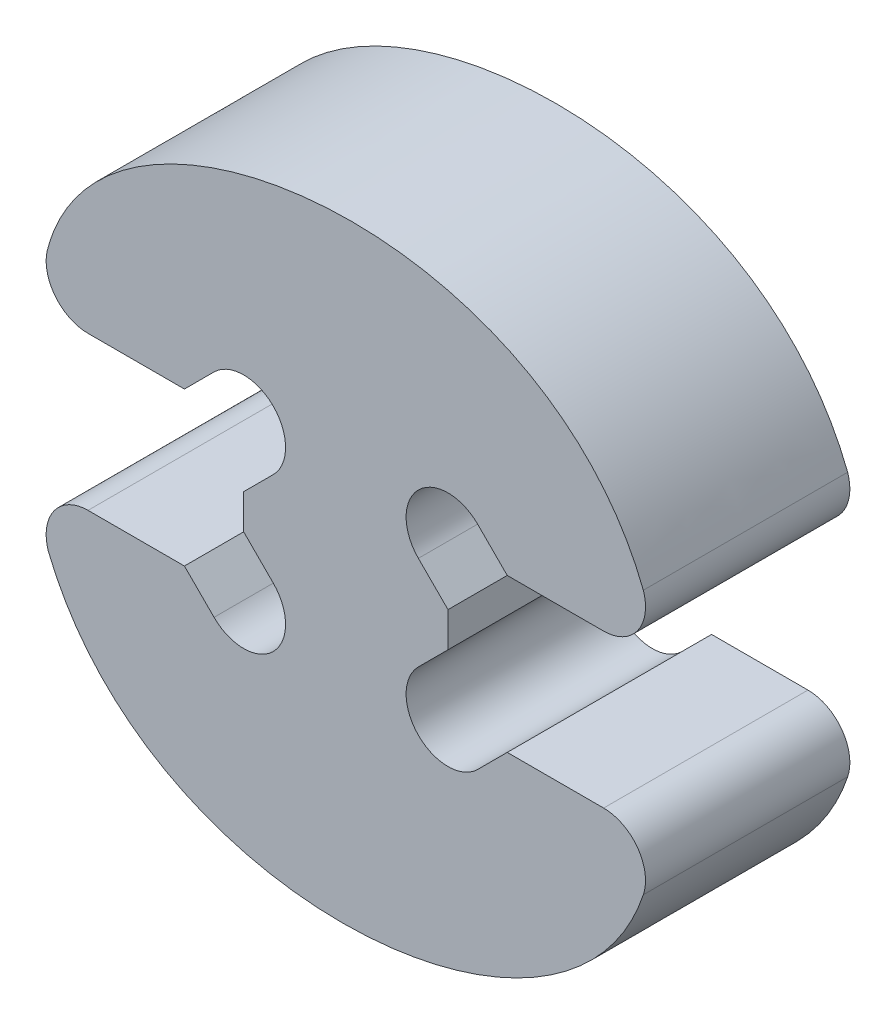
SolidWorks part; units mm, degrees
ref_plane "Front Plane" through (0, 0, 0) normal (0, 0, 1) x (1, 0, 0)
ref_plane "Top Plane" through (0, 0, 0) normal (0, 1, 0) x (1, 0, 0)
ref_plane "Right Plane" through (0, 0, 0) normal (1, 0, 0) x (0, 0, -1)
sketch "Model" plane through (0, 0, 0) normal (0, 0, 1) x (1, 0, 0)
  line L4 (543.2322, 187.641) -> (533.7957, 187.641)
  line L5 (533.7957, 187.641) -> (530.8965, 184.7419)
  line L6 (525.0983, 190.5401) -> (527.9974, 193.4393)
  line L7 (527.9974, 193.4393) -> (527.9974, 196.8427)
  line L8 (527.9974, 196.8427) -> (525.0983, 199.7419)
  line L9 (530.8965, 205.5401) -> (533.7957, 202.641)
  line L10 (533.7957, 202.641) -> (543.2322, 202.641)
  line L11 (492.7627, 202.641) -> (502.1991, 202.641)
  line L12 (502.1991, 202.641) -> (505.0983, 205.5401)
  line L13 (510.8965, 199.7419) -> (507.9974, 196.8427)
  line L14 (507.9974, 196.8427) -> (507.9974, 193.4393)
  line L15 (507.9974, 193.4393) -> (510.8965, 190.5401)
  line L16 (505.0983, 184.7419) -> (502.1991, 187.641)
  line L17 (502.1991, 187.641) -> (492.7627, 187.641)
  arc A0 (488.877, 182.2329) -> (490.7593, 178.2111) centre (507.014, 188.2701) ccw
  arc A1 (490.7593, 178.2111) -> (493.6192, 174.5278) centre (509.5533, 189.8515) ccw
  arc A2 (493.6192, 174.5278) -> (497.3539, 171.315) centre (512.3895, 192.5705) ccw
  arc A3 (497.3539, 171.315) -> (501.8295, 168.6881) centre (514.9301, 196.1346) ccw
  arc A4 (501.8295, 168.6881) -> (506.8852, 166.7414) centre (516.7485, 199.8956) ccw
  arc A5 (506.8852, 166.7414) -> (512.3398, 165.5447) centre (517.7072, 203.0388) ccw
  arc A6 (512.3398, 165.5447) -> (517.9974, 165.141) centre (517.9863, 204.8282) ccw
  arc A7 (517.9974, 165.141) -> (523.655, 165.5447) centre (518.0085, 204.8282) ccw
  arc A8 (523.655, 165.5447) -> (529.1096, 166.7414) centre (518.2876, 203.0388) ccw
  arc A9 (529.1096, 166.7414) -> (534.1653, 168.6881) centre (519.2463, 199.8956) ccw
  arc A10 (534.1653, 168.6881) -> (538.6409, 171.315) centre (521.0647, 196.1346) ccw
  arc A11 (538.6409, 171.315) -> (542.3756, 174.5278) centre (523.6054, 192.5705) ccw
  arc A12 (542.3756, 174.5278) -> (545.2355, 178.2111) centre (526.4415, 189.8515) ccw
  arc A13 (545.2355, 178.2111) -> (547.1179, 182.2329) centre (528.981, 188.2704) ccw
  arc A14 (547.1179, 182.2329) -> (543.2322, 187.641) centre (543.2322, 183.541) ccw
  arc A15 (525.0983, 190.5401) -> (530.8965, 184.7419) centre (527.9974, 187.641) ccw
  arc A16 (530.8965, 205.5401) -> (525.0983, 199.7419) centre (527.9974, 202.641) ccw
  arc A17 (543.2322, 202.641) -> (547.1179, 208.0491) centre (543.2322, 206.741) ccw
  arc A18 (547.1179, 208.0491) -> (545.2355, 212.0709) centre (528.981, 202.0116) ccw
  arc A19 (545.2355, 212.0709) -> (542.3756, 215.7542) centre (526.4415, 200.4305) ccw
  arc A20 (542.3756, 215.7542) -> (538.6409, 218.967) centre (523.6054, 197.7115) ccw
  arc A21 (538.6409, 218.967) -> (534.1653, 221.5939) centre (521.0647, 194.1474) ccw
  arc A22 (534.1653, 221.5939) -> (529.1096, 223.5406) centre (519.2463, 190.3864) ccw
  arc A23 (529.1096, 223.5406) -> (523.655, 224.7373) centre (518.2876, 187.2432) ccw
  arc A24 (523.655, 224.7373) -> (517.9974, 225.141) centre (518.0085, 185.4538) ccw
  arc A25 (517.9974, 225.141) -> (512.3398, 224.7373) centre (517.9863, 185.4538) ccw
  arc A26 (512.3398, 224.7373) -> (506.8852, 223.5406) centre (517.7072, 187.2432) ccw
  arc A27 (506.8852, 223.5406) -> (501.8295, 221.5939) centre (516.7485, 190.3864) ccw
  arc A28 (501.8295, 221.5939) -> (497.3539, 218.967) centre (514.9301, 194.1474) ccw
  arc A29 (497.3539, 218.967) -> (493.6192, 215.7542) centre (512.3895, 197.7115) ccw
  arc A30 (493.6192, 215.7542) -> (490.7593, 212.0709) centre (509.5533, 200.4305) ccw
  arc A31 (490.7593, 212.0709) -> (488.877, 208.0491) centre (507.014, 202.0119) ccw
  arc A32 (488.877, 208.0491) -> (492.7627, 202.641) centre (492.7627, 206.741) ccw
  arc A33 (510.8965, 199.7419) -> (505.0983, 205.5401) centre (507.9974, 202.641) ccw
  arc A34 (505.0983, 184.7419) -> (510.8965, 190.5401) centre (507.9974, 187.641) ccw
  arc A35 (492.7627, 187.641) -> (488.877, 182.2329) centre (492.7627, 183.541) ccw
sketch "Sketch2" plane through (0, 0, 0) normal (0, 0, 1) x (1, 0, 0)
  line L0 (533.7957, 187.641) -> (543.2322, 187.641)
  line L1 (533.7957, 202.641) -> (543.2322, 202.641)
  line L2 (533.7957, 202.641) -> (530.8965, 205.5401)
  line L3 (533.7957, 187.641) -> (530.8965, 184.7419)
  line L4 (492.7627, 202.641) -> (502.1991, 202.641)
  line L5 (502.1991, 202.641) -> (505.0983, 205.5401)
  line L6 (510.8965, 199.7419) -> (507.9974, 196.8427) construction
  line L7 (510.8965, 199.7419) -> (507.9974, 196.8427)
  line L10 (507.9974, 196.8427) -> (507.9974, 193.4393)
  line L11 (507.9974, 193.4393) -> (510.8965, 190.5401)
  line L12 (505.0983, 184.7419) -> (502.1991, 187.641)
  line L13 (502.1991, 187.641) -> (492.7627, 187.641)
  line L14 (525.0983, 190.5401) -> (527.9974, 193.4393)
  line L15 (527.9974, 193.4393) -> (527.9974, 196.8427)
  line L16 (527.9974, 196.8427) -> (525.0983, 199.7419)
  arc A0 (543.2322, 202.641) -> (547.1179, 208.0491) centre (543.2322, 206.741) ccw
  arc A1 (510.8965, 190.5401) -> (505.0983, 184.7419) centre (507.9974, 187.641) cw
  arc A2 (543.2322, 202.641) -> (547.1179, 208.0491) centre (543.2322, 206.741) ccw construction
  arc A3 (488.877, 208.0491) -> (492.7627, 202.641) centre (492.7627, 206.741) ccw
  arc A4 (488.877, 208.0491) -> (492.7627, 202.641) centre (492.7627, 206.741) ccw construction
  arc A5 (492.7627, 187.641) -> (488.877, 182.2329) centre (492.7627, 183.541) ccw
  arc A6 (492.7627, 187.641) -> (488.877, 182.2329) centre (492.7627, 183.541) ccw construction
  arc A7 (547.1179, 182.2329) -> (543.2322, 187.641) centre (543.2322, 183.541) ccw
  arc A8 (505.0983, 184.7419) -> (510.8965, 190.5401) centre (507.9974, 187.641) ccw construction
  arc A9 (547.1179, 182.2329) -> (543.2322, 187.641) centre (543.2322, 183.541) ccw construction
  arc A10 (505.0983, 205.5401) -> (510.8965, 199.7419) centre (507.9974, 202.641) cw
  arc A11 (530.8965, 184.7419) -> (525.0983, 190.5401) centre (527.9974, 187.641) cw
  arc A12 (525.0983, 190.5401) -> (530.8965, 184.7419) centre (527.9974, 187.641) ccw construction
  arc A13 (530.8965, 205.5401) -> (525.0983, 199.7419) centre (527.9974, 202.641) ccw
  arc A16 (530.8965, 205.5401) -> (525.0983, 199.7419) centre (527.9974, 202.641) ccw construction
  spline S0 degree 3 poles (488.877, 208.0491) (494.4624, 228.0417) (537.2993, 233.2102) (547.1179, 208.0491) knots 0 0 0 0 1 1 1 1
  spline S1 degree 3 poles (488.877, 182.2329) (498.8013, 157.6795) (540.1075, 161.2114) (547.1179, 182.2329) knots 0 0 0 0 1 1 1 1
extrude "Boss-Extrude1" add sketch "Sketch2" along normal blind 20
